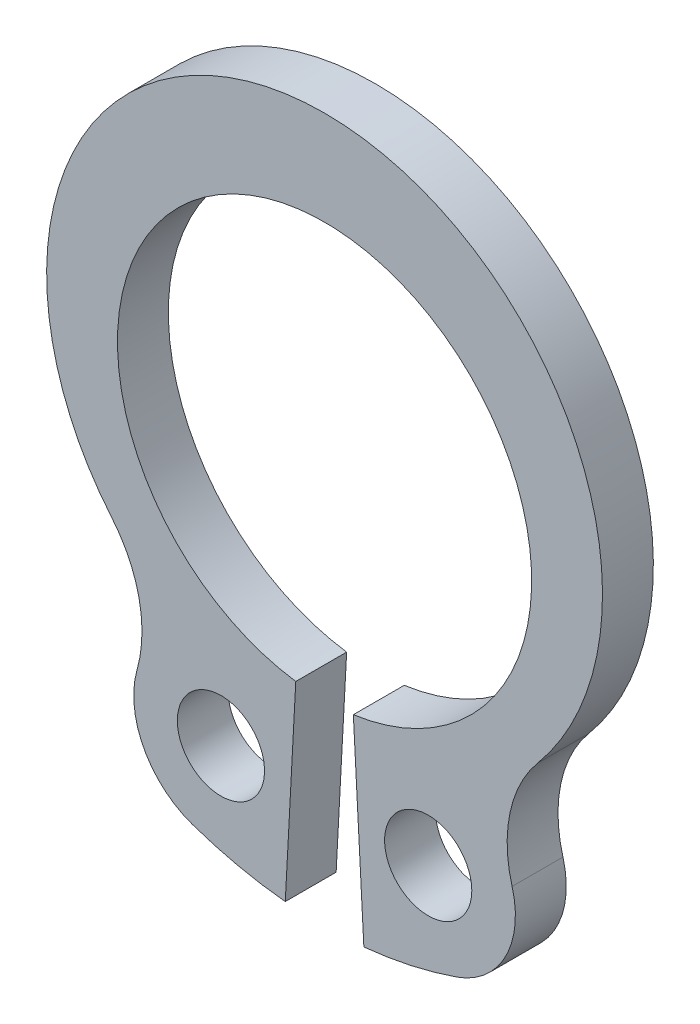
SolidWorks part; units mm, degrees
ref_plane "Face" through (0, 0, 0) normal (0, 0, 1) x (1, 0, 0)
ref_plane "Dessus" through (0, 0, 0) normal (0, 1, 0) x (1, 0, 0)
ref_plane "Droite" through (0, 0, 0) normal (1, 0, 0) x (0, 0, -1)
sketch "Esquisse1" plane through (0, 0, 0) normal (0, 0, 1) x (1, 0, 0)
  line L0 (0, 4.15) -> (0, 2.85) construction
  line L1 (0.3961, -2.8223) -> (0.5408, -5.5185)
  line L2 (-0.3961, -2.8223) -> (-0.5408, -5.5185)
  line L3 (0.24, -2.7897) -> (0.24, -5.4897) construction
  line L4 (-0.24, -2.7897) -> (-0.24, -5.4897) construction
  arc A0 (0.3961, -2.8223) -> (-0.3961, -2.8223) centre (0, 0) ccw
  arc A1 (2.9326, -2.1307) -> (-2.9326, -2.1307) centre (0, 0.325) ccw
  arc A2 (0.5408, -5.5185) -> (1.8202, -5.2376) centre (0, 0) ccw
  circle A3 centre (1.4263, -4.1041) radius 0.6
  arc A4 (1.8202, -5.2376) -> (2.5808, -3.777) centre (1.4263, -4.1041) ccw
  arc A5 (2.9326, -2.1307) -> (2.5808, -3.777) centre (4.3126, -3.2863) ccw
  circle A6 centre (-1.4263, -4.1041) radius 0.6
  arc A7 (-2.9326, -2.1307) -> (-2.5808, -3.777) centre (-4.3126, -3.2863) cw
  arc A8 (-1.8202, -5.2376) -> (-2.5808, -3.777) centre (-1.4263, -4.1041) cw
  arc A9 (-0.5408, -5.5185) -> (-1.8202, -5.2376) centre (0, 0) cw
  arc A10 (0.24, -2.7897) -> (-0.24, -2.7897) centre (0, 0) ccw construction
  circle A11 centre (0, 0) radius 3 construction
  dimension "dgorge" = 5.7
  dimension "D3" = 0.325
  dimension "dtrou" = 1.2
  dimension "D8" = 1.2
  dimension "D9" = 1.8
  dimension "dint" = 5.6
  dimension "dn" = 6
  dimension "b" = 1.3
  dimension "a" = 2.7
  dimension "D5" = 15.977
  dimension "D7" = 0.96
  dimension "D12" = 0.48
  dimension "D13" = 9.834
  dimension "D14" = 3.072
extrude "Base-Extrusion" add sketch "Esquisse1" along normal blind 0.7
equation "\"D3@Esquisse1\" = \"b@Esquisse1\"/4"
equation "\"D7@Esquisse1\"=\"dtrou@Esquisse1\"*0.8"
equation "\"D8@Esquisse1\" = \"dtrou@Esquisse1\""
equation "\"D9@Esquisse1\" = \"dtrou@Esquisse1\"*1.5"
equation "\"D12@Esquisse1\" = \"dtrou@Esquisse1\"*0.4"
equation "\"D5@Esquisse1\" = 360-(360-\"D13@Esquisse1\")*\"dint@Esquisse1\"/\"dgorge@Esquisse1\""
equation "\"D14@Esquisse1\" = (\"D5@Esquisse1\"-\"D13@Esquisse1\")/2"
